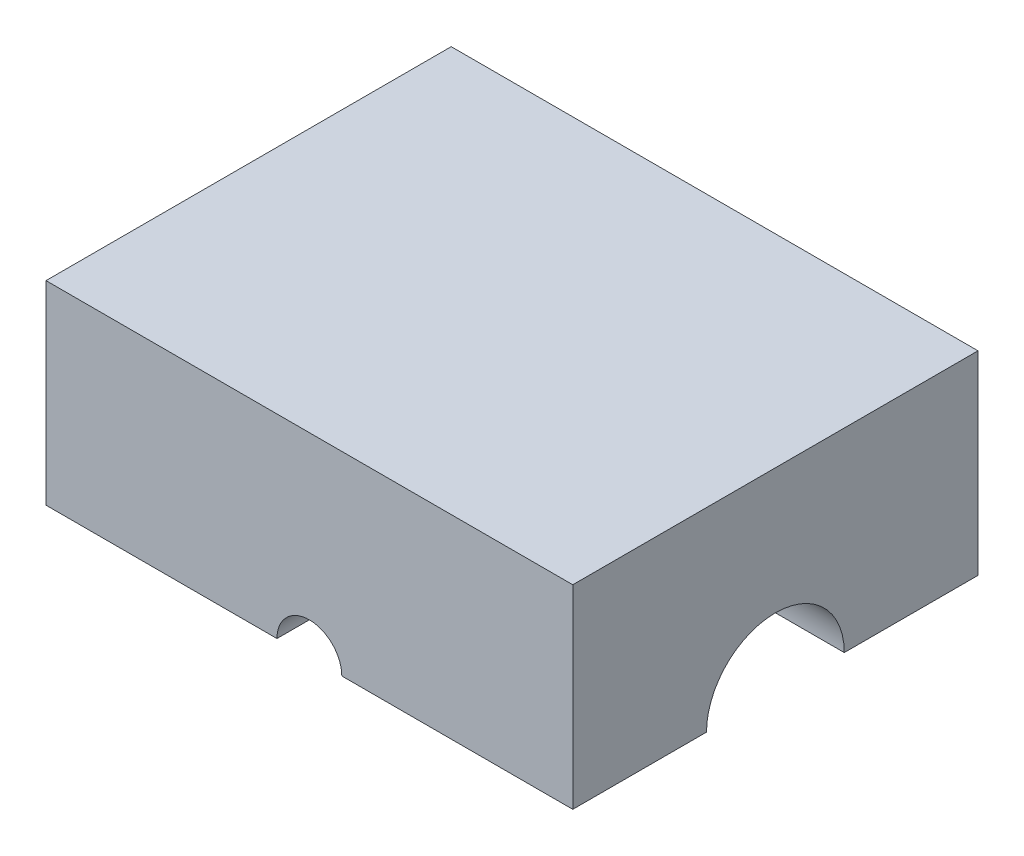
SolidWorks part; units mm, degrees
ref_plane "Front Plane" through (0, 0, 0) normal (0, 0, 1) x (1, 0, 0)
ref_plane "Top Plane" through (0, 0, 0) normal (0, 1, 0) x (1, 0, 0)
ref_plane "Right Plane" through (0, 0, 0) normal (1, 0, 0) x (0, 0, -1)
sketch "Sketch1" plane through (0, 0, 0) normal (0, 1, 0) x (1, 0, 0)
  line L0 (206.375, -158.75) -> (-206.375, 158.75) construction
  line L1 (-206.375, 158.75) -> (206.375, 158.75)
  line L2 (-206.375, 158.75) -> (-206.375, -158.75)
  line L3 (-206.375, -158.75) -> (206.375, -158.75)
  line L4 (206.375, 158.75) -> (206.375, -158.75)
  dimension "D1" = 317.5
  dimension "D2" = 412.75
extrude "Extrude1" add sketch "Sketch1" along normal blind 152.4
sketch "Sketch2" plane through (0, 0, 0) normal (0, 1, 0) x (1, 0, 0)
  line L0 (0, -158.75) -> (25.4, -158.75)
  line L1 (-206.375, -158.75) -> (206.375, -158.75) construction
  line L2 (25.4, -158.75) -> (25.4, -95.25)
  line L3 (25.4, -95.25) -> (76.2, -95.25)
  line L4 (76.2, -95.25) -> (76.2, 95.25)
  line L5 (76.2, 95.25) -> (25.4, 95.25)
  line L6 (25.4, 95.25) -> (25.4, 158.75)
  line L7 (206.375, 158.75) -> (-206.375, 158.75) construction
  line L8 (25.4, 158.75) -> (0, 158.75)
  line L9 (0, 158.75) -> (0, -158.75)
  line L10 (0, -189.626) -> (0, 189.5068) construction
  dimension "D1" = 76.2
  dimension "D2" = 63.5
  dimension "D3" = 25.4
revolve "Cut-Revolve1" cut sketch "Sketch2" angle 360 about L10
sketch "Sketch3" plane through (0, 0, 0) normal (1, 0, 0) x (0, 0, -1)
  circle A0 centre (0, 0) radius 53.975
  dimension "D1" = 107.95
extrude "Extrude2" cut sketch "Sketch3" against normal through all and the other way through all
fillet "Fillet1" radius 25.4 2 edges at (53.9569, 53.806, -4.2675) (-53.9569, 53.806, 4.2675)
